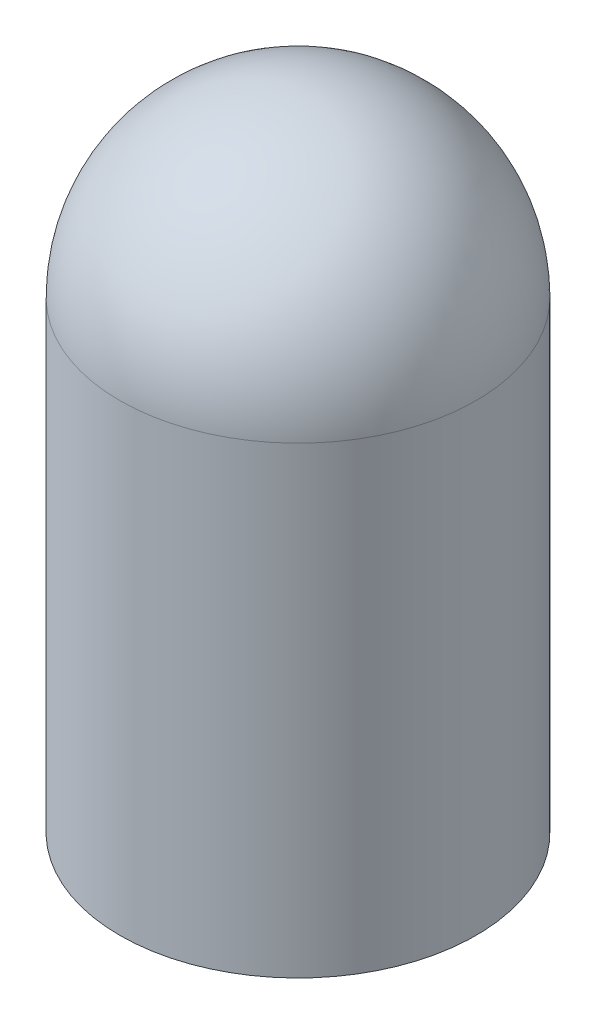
SolidWorks part; units mm, degrees
ref_plane "Front Plane" through (0, 0, 0) normal (0, 0, 1) x (1, 0, 0)
ref_plane "Top Plane" through (0, 0, 0) normal (0, 1, 0) x (1, 0, 0)
ref_plane "Right Plane" through (0, 0, 0) normal (1, 0, 0) x (0, 0, -1)
other "Center of Mass"
sketch "Sketch1" plane through (0, 0, 0) normal (0, 1, 0) x (1, 0, 0)
  circle A0 centre (0, 0) radius 5
  dimension "D1" = 10
extrude "Boss-Extrude1" add sketch "Sketch1" along normal blind 18
fillet "Fillet7" radius 5 1 edges at (0, 18, 5)
sketch "Sketch2" plane through (0, 0, 0) normal (0, -1, 0) x (1, 0, 0)
  point P0 (0, 0)
hole_wizard "Tap Drill for #10-32 Tap1" positions "Sketch3" profile "Sketch5" hole size "#10-32" standard "ANSI Inch"
sketch "Sketch3" plane through (0, 0, 0) normal (0, -1, 0) x (-1, 0, 0)
  point P0 (0, 0)
sketch "Sketch5" plane through (0, 0, 0) normal (1, 0, 0) x (0, 0, -1)
  line L0 (0, 0) -> (0, 14.2133)
  line L1 (0, 14.2133) -> (2.0193, 13)
  line L2 (2.0193, 13) -> (2.0193, 0)
  line L5 (2.0193, 0) -> (0, 0)
  line L10 (0, 14.2133) -> (-2.0193, 13) construction
  line L11 (0, -6.35) -> (0, 107.95) construction
  dimension "Hole Dia." = 4.0386
  dimension "Hole Depth" = 13
  dimension "Drill Angle" = 118
